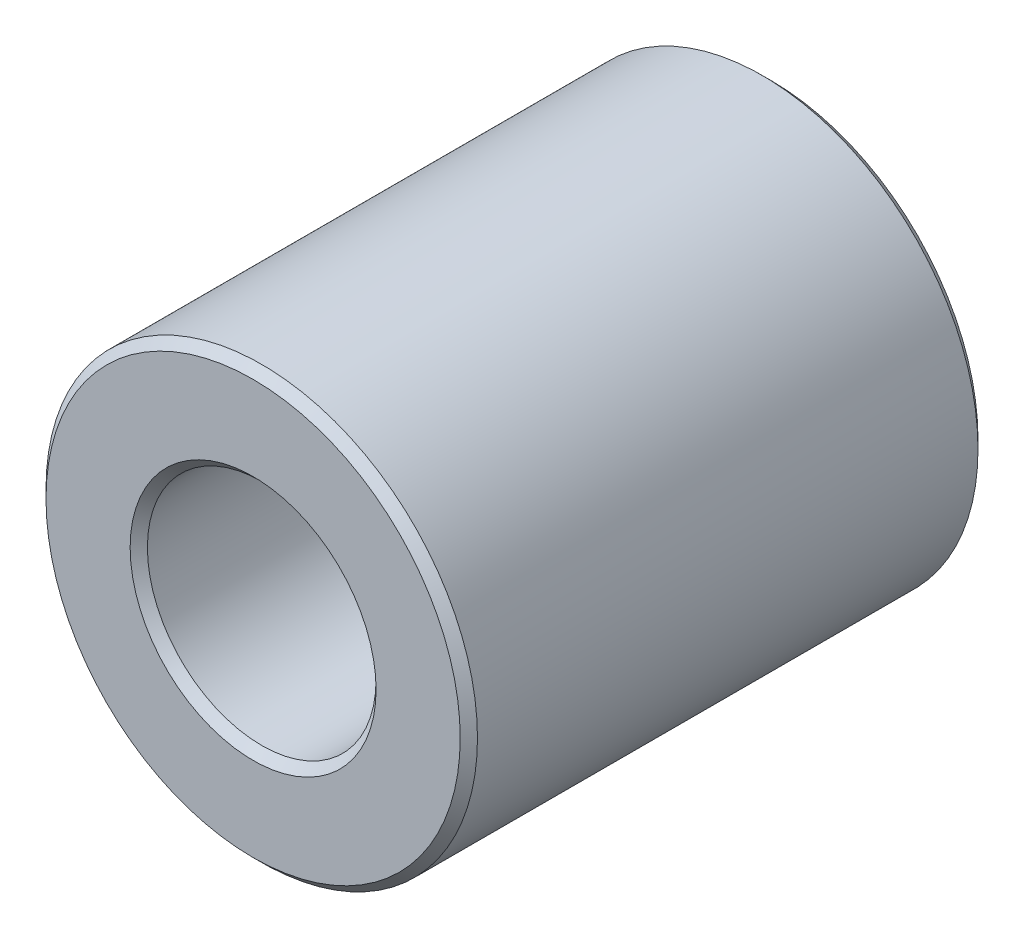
SolidWorks part; units mm, degrees
ref_plane "Front Plane" through (0, 0, 0) normal (0, 0, 1) x (1, 0, 0)
ref_plane "Top Plane" through (0, 0, 0) normal (0, 1, 0) x (1, 0, 0)
ref_plane "Right Plane" through (0, 0, 0) normal (1, 0, 0) x (0, 0, -1)
sketch "Sketch1" plane through (0, 0, 0) normal (0, 0, 1) x (1, 0, 0)
  circle A0 centre (0, 0) radius 5
  circle A1 centre (0, 0) radius 2.65
  dimension "D1" = 10
  dimension "D2" = 5.3
extrude "Boss-Extrude2" add sketch "Sketch1" along normal mid plane 12
chamfer "Chamfer3" distance 0.2 angle 45 4 edges at (5, 0, 6) (5, 0, -6) (2.65, 0, -6) (2.65, 0, 6)
